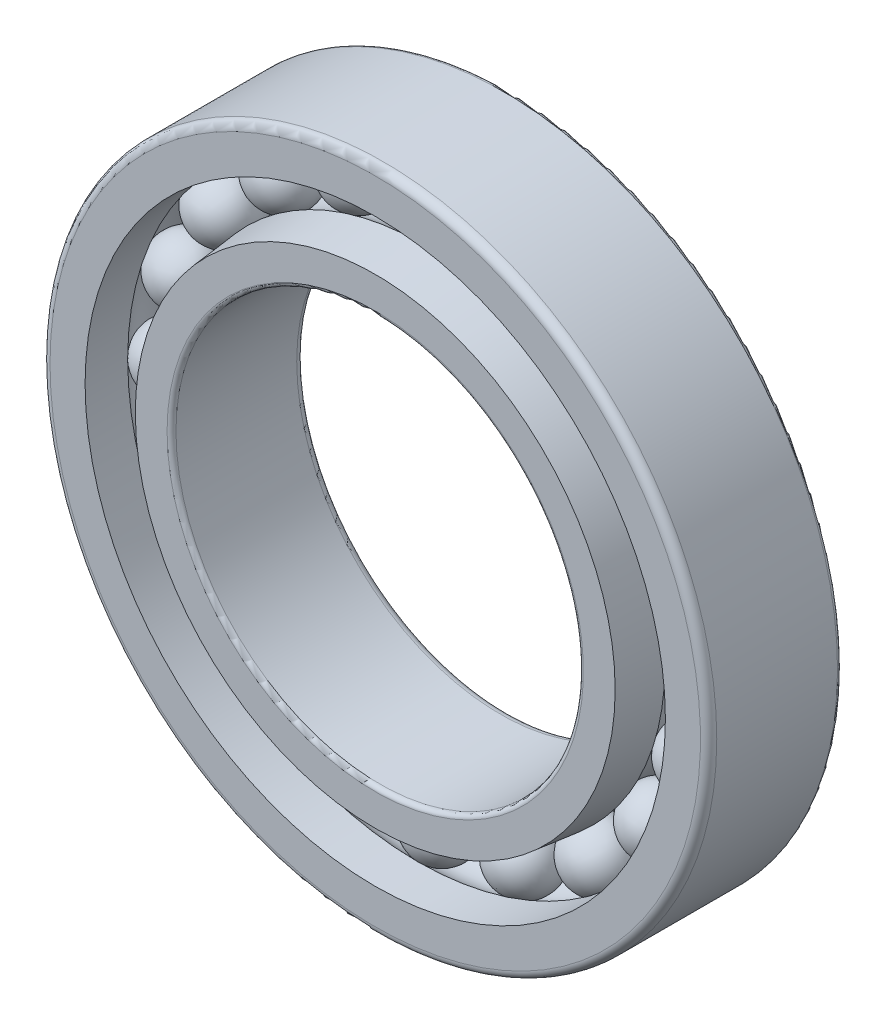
SolidWorks part; units mm, degrees
ref_plane "Front Plane" through (0, 0, 0) normal (0, 0, 1) x (1, 0, 0)
ref_plane "Top Plane" through (0, 0, 0) normal (0, 1, 0) x (1, 0, 0)
ref_plane "Right Plane" through (0, 0, 0) normal (1, 0, 0) x (0, 0, -1)
other "Configuration Table"
sketch "BaseSke" plane through (0, 0, 0) normal (1, 0, 0) x (0, 0, -1)
  line L0 (-47.2296, 0) -> (24.6132, 0) construction
  line L1 (-47.2296, 36.25) -> (24.6132, 36.25) construction
  line L2 (0, 129.5214) -> (0, -86.3012) construction
  line L3 (0, 40.625) -> (0, 31.875)
  line L4 (-9, 45) -> (9, 45) construction
  line L5 (-9, 27.5) -> (9, 27.5) construction
  arc A0 (0, 40.625) -> (0, 31.875) centre (0, 36.25) ccw
revolve "Ball" add sketch "BaseSke" angle 360 about L3
sketch "OuterRaceSke" plane through (0, 0, 0) normal (1, 0, 0) x (0, 0, -1)
  line L0 (0, 0) -> (0, 87.5396) construction
  line L1 (-9, 45) -> (9, 45)
  line L2 (-9, 45) -> (-9, 39.1667)
  line L3 (-9, 39.1667) -> (-3.2475, 39.1667)
  line L4 (9, 45) -> (9, 40.1126)
  line L5 (-50.3916, 0) -> (55.2197, 0) construction
  line L6 (-47.2296, 36.25) -> (24.6132, 36.25) construction
  line L8 (9, 40.1126) -> (2.9407, 39.4757)
  line L9 (0, 39.1667) -> (-5.0325, 57.9482) construction
  line L10 (0, 39.1667) -> (2.9407, 39.4757) construction
  arc A0 (2.9407, 39.4757) -> (-3.2475, 39.1667) centre (0, 36.25) ccw
revolve "OuterRace" add sketch "OuterRaceSke" angle 360 about L5
sketch "InnerRaceSke" plane through (0, 0, 0) normal (1, 0, 0) x (0, 0, -1)
  line L0 (-70.8626, 0) -> (113.5527, 0) construction
  line L1 (0, 58.441) -> (0, -70.8113) construction
  line L2 (-9, 27.5) -> (9, 27.5)
  line L3 (-9, 27.5) -> (-9, 33.3333)
  line L4 (-9, 33.3333) -> (-3.2475, 33.3333)
  line L5 (9, 27.5) -> (9, 33.3333)
  line L6 (0, 129.5214) -> (0, -86.3012) construction
  line L7 (3.2475, 33.3333) -> (9, 33.3333)
  arc A0 (-3.2475, 33.3333) -> (3.2475, 33.3333) centre (0, 36.25) ccw
  arc A1 (0, 40.625) -> (0, 31.875) centre (0, 36.25) ccw construction
revolve "InnerRace" add sketch "InnerRaceSke" angle 360 about L0
fillet "Fillet1" radius 1.1 2 edges at (27.5, 0, -9) (45, 0, 9)
fillet "Fillet2" radius 0.6 2 edges at (45, 0, -9) (27.5, 0, 9)
sketch "CutInnerRaceSke" plane through (0, 0, 0) normal (1, 0, 0) x (0, 0, -1)
  line L0 (-3.2475, 33.3333) -> (-9, 33.3333)
  line L1 (-9, 33.3333) -> (-9, 32.3874)
  line L2 (-9, 32.3874) -> (-2.9407, 33.0243)
  line L3 (-2.9407, 33.0243) -> (0, 33.3333) construction
  line L4 (0, 58.441) -> (0, -70.8113) construction
  line L5 (-28.3066, 0) -> (35.2466, 0) construction
  arc A0 (-3.2475, 33.3333) -> (-2.9407, 33.0243) centre (0, 36.25) ccw
  arc A1 (-3.2475, 33.3333) -> (3.2475, 33.3333) centre (0, 36.25) ccw construction
revolve "CutInnerRace" cut sketch "CutInnerRaceSke" angle 360 about L5
pattern_circular "CirPatternBall" count 20 over 360 about axis through (0, 0, 0) along (0, 0, 1) of "Ball"
sketch "SimplifiedSke" plane through (0, 0, 0) normal (1, 0, 0) x (0, 0, -1)
  line L0 (37.5911, 0) -> (-37.5911, 0) construction
  circle A0 centre (0, 36.25) radius 4.375
  arc A1 (0, 40.625) -> (0, 31.875) centre (0, 36.25) ccw construction
revolve "Simplified" [suppressed] add sketch "SimplifiedSke" angle 360 about L0
equation "\"D1@BaseSke\" =  (\"Bearing_Outside_Diameter@BaseSke\"  +  \"Bearing_Inside_Diameter@BaseSke\"  )  / 4"
equation "\"Ball_diameter@BaseSke\" =  ( \"Bearing_Outside_Diameter@BaseSke\" - \"Bearing_Inside_Diameter@BaseSke\" ) / 4 "
equation "\"D2@OuterRaceSke\" = \"Bearing_Outside_Diameter@BaseSke\" -  ( \"Bearing_Outside_Diameter@BaseSke\" - \"Bearing_Inside_Diameter@BaseSke\" )  / 3"
equation "\"D4@OuterRaceSke\" = (  \"Bearing_Outside_Diameter@BaseSke\" - \"Bearing_Inside_Diameter@BaseSke\" ) / 4 -0.02"
equation "\"D3@OuterRaceSke\" = \"Angle@OuterRaceSke\"/2.5"
equation "\"D1@InnerRaceSke\" = \"Bearing_Inside_Diameter@BaseSke\" +  ( \"Bearing_Outside_Diameter@BaseSke\" - \"Bearing_Inside_Diameter@BaseSke\" )  / 3"
equation "\"D2@InnerRaceSke\" = \"D4@OuterRaceSke\""
equation "\"D1@CirPatternBall\" = int( \"D1@BaseSke\"* pi  * 2 / \"Ball_diameter@BaseSke\"/1.2 ) -1"
equation "\"D1@CutInnerRaceSke\" = \"D3@OuterRaceSke\""
